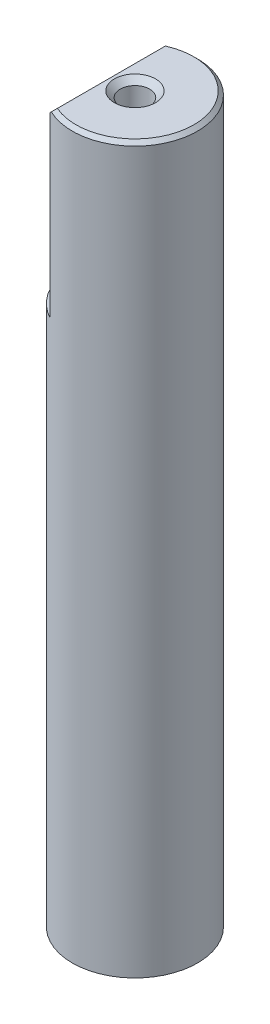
SolidWorks part; units mm, degrees
ref_plane "Front Plane" through (0, 0, 0) normal (0, 0, 1) x (1, 0, 0)
ref_plane "Top Plane" through (0, 0, 0) normal (0, 1, 0) x (1, 0, 0)
ref_plane "Right Plane" through (0, 0, 0) normal (1, 0, 0) x (0, 0, -1)
sketch "Sketch1" plane through (0, 0, 0) normal (0, 1, 0) x (1, 0, 0)
  circle A0 centre (0, 0) radius 8.5
  dimension "D1" = 17
extrude "Boss-Extrude1" add sketch "Sketch1" along normal blind 97.5
sketch "Sketch2" plane through (0, 97.5, 0) normal (0, 1, 0) x (1, 0, 0)
  circle A0 centre (0, 0) radius 8
  dimension "D1" = 16
extrude "Boss-Extrude2" add sketch "Sketch2" along normal blind 0.8
chamfer "Chamfer1" distance 0.8 angle 45 1 edges at (0, 97.5, 8)
sketch "Sketch3" plane through (0, 98.3, 0) normal (0, 1, 0) x (1, 0, 0)
  circle A0 centre (0, 0) radius 2
  dimension "D1" = 4
extrude "Cut-Extrude1" cut sketch "Sketch3" against normal blind 19
sketch "Sketch4" plane through (0, 98.3, 0) normal (0, 1, 0) x (1, 0, 0)
  circle A0 centre (0, 0) radius 2.8
  dimension "D1" = 5.6
extrude "Cut-Extrude2" cut sketch "Sketch4" against normal blind 0.8
chamfer "Chamfer2" distance 0.8 angle 45 1 edges at (0, 97.5, 2.8)
sketch "Sketch5" plane through (0, 98.3, 0) normal (0, 1, 0) x (1, 0, 0)
  line L0 (-2.8, 0) -> (-4, 0) construction
  line L1 (-4, 0) -> (-4, 7.5)
  line L2 (-4, 0) -> (-4, -7.5)
  circle A0 centre (0, 0) radius 2.8 construction
  circle A1 centre (0, 0) radius 8.5 construction
  arc A2 (-4, 7.5) -> (-4, -7.5) centre (0, 0) ccw
  dimension "D1" = 1.2
extrude "Cut-Extrude3" cut sketch "Sketch5" against normal blind 25
chamfer "Chamfer3" distance 0.8 angle 45 1 edges at (-4, 98.3, 0)
